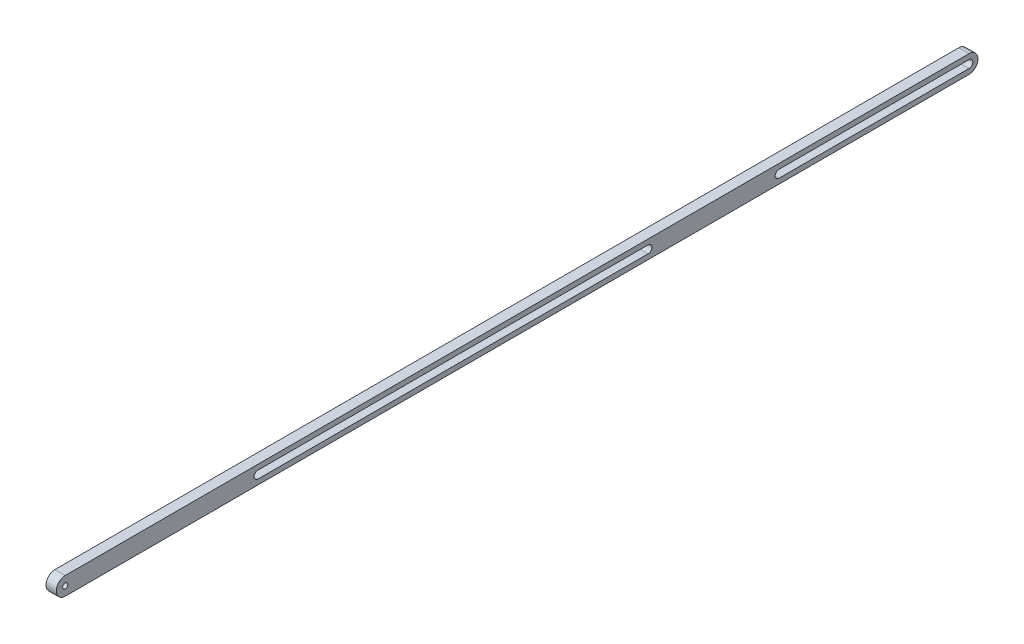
SolidWorks part; units mm, degrees
ref_plane "Front Plane" through (0, 0, 0) normal (0, 0, 1) x (1, 0, 0)
ref_plane "Top Plane" through (0, 0, 0) normal (0, 1, 0) x (1, 0, 0)
ref_plane "Right Plane" through (0, 0, 0) normal (1, 0, 0) x (0, 0, -1)
sketch "Sketch2" plane through (0, 0, 0) normal (1, 0, 0) x (0, 0, -1)
  line L0 (0, 0) -> (1760, 0) construction
  line L1 (0, 17.5) -> (1760, 17.5)
  line L2 (0, -17.5) -> (1760, -17.5)
  line L3 (0, 0) -> (375, 0) construction
  line L4 (375, 0) -> (1135, 0) construction
  line L5 (375, 7.5) -> (1135, 7.5)
  line L6 (375, -7.5) -> (1135, -7.5)
  line L7 (0, 0) -> (375, 0) construction
  line L8 (1135, 0) -> (1760, 0) construction
  line L9 (1760, 0) -> (1390, 0) construction
  line L10 (1760, -7.5) -> (1390, -7.5)
  line L11 (1760, 7.5) -> (1390, 7.5)
  arc A0 (0, 17.5) -> (0, -17.5) centre (0, 0) ccw
  arc A1 (1760, -17.5) -> (1760, 17.5) centre (1760, 0) ccw
  circle A2 centre (0, 0) radius 5
  arc A3 (1760, -7.5) -> (1760, 7.5) centre (1760, 0) ccw
  arc A4 (375, 7.5) -> (375, -7.5) centre (375, 0) ccw
  arc A5 (1135, -7.5) -> (1135, 7.5) centre (1135, 0) ccw
  arc A6 (1390, 7.5) -> (1390, -7.5) centre (1390, 0) ccw
  point P3 (880, 0)
  point P11 (1575, 0)
  point P12 (755, 0)
  dimension "D1" = 375
  dimension "D3" = 760
  dimension "D2" = 625
extrude "Boss-Extrude1" add sketch "Sketch2" along normal blind 20
